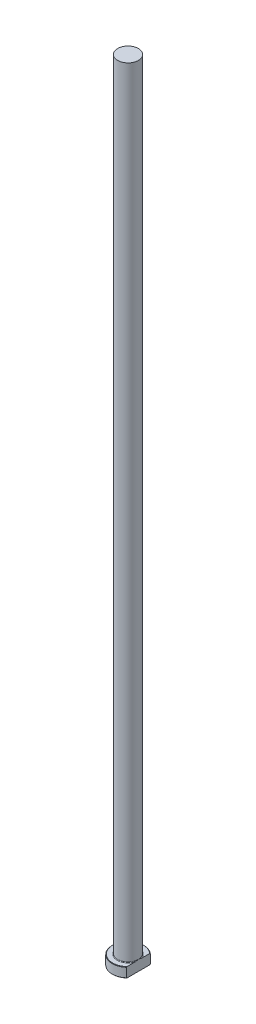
SolidWorks part; units mm, degrees
ref_plane "Front Plane" through (0, 0, 0) normal (0, 0, 1) x (1, 0, 0)
ref_plane "Top Plane" through (0, 0, 0) normal (0, 1, 0) x (1, 0, 0)
ref_plane "Right Plane" through (0, 0, 0) normal (1, 0, 0) x (0, 0, -1)
sketch "Sketch1" plane through (0, 0, 0) normal (0, 0, 1) x (1, 0, 0)
  line L0 (0, 259.9588) -> (0, -15.1925) construction
  line L1 (0, 0) -> (-8, 0)
  line L2 (-8, 0) -> (-8, 5)
  line L3 (-8, 5) -> (-5.25, 5)
  line L4 (-5.25, 5) -> (-5.25, 400)
  line L5 (-5.25, 400) -> (0, 400)
  line L6 (0, 400) -> (0, 0)
  dimension "L" = 400
  dimension "H" = 16
  dimension "T" = 5
  dimension "D" = 10.5
revolve "Revolve1" add sketch "Sketch1" angle 360 about L0
chamfer "Chamfer1" distance 0.2 angle 45 2 edges at (0, 5, 8) (0, 0, 8)
fillet "Fillet1" radius 0.3 1 edges at (0, 5, 5.25)
sketch "Sketch2" plane through (0, 0, 0) normal (0, 1, 0) x (1, 0, 0)
  line L0 (5.25, 6.0363) -> (5.25, -6.0363)
  circle A0 centre (0, 0) radius 8 construction
  arc A1 (5.25, -6.0363) -> (5.25, 6.0363) centre (0, 0) ccw
  circle A2 centre (0, 0) radius 5.25 construction
extrude "KEY" cut sketch "Sketch2" along normal through all
